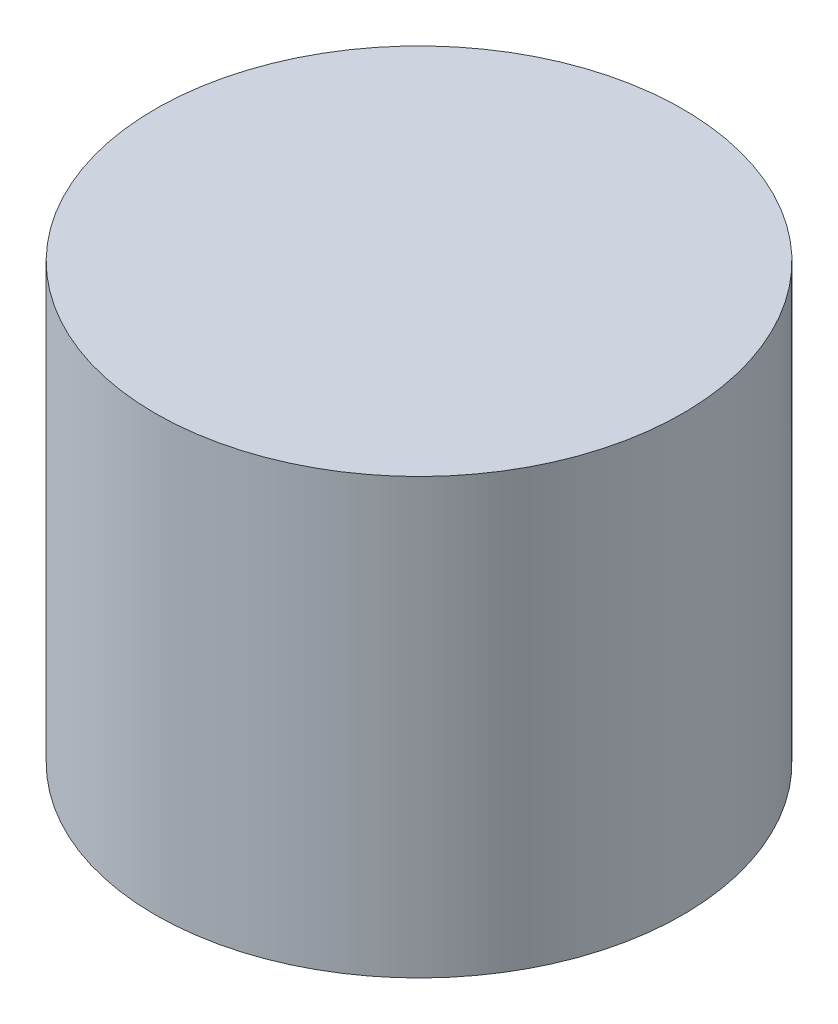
SolidWorks part; units mm, degrees
ref_plane "Front Plane" through (0, 0, 0) normal (0, 0, 1) x (1, 0, 0)
ref_plane "Top Plane" through (0, 0, 0) normal (0, 1, 0) x (1, 0, 0)
ref_plane "Right Plane" through (0, 0, 0) normal (1, 0, 0) x (0, 0, -1)
sketch "Sketch3" plane through (0, 0, 0) normal (0, 1, 0) x (-1, 0, 0)
  circle A1 centre (54, 28) radius 4.25
extrude "Boss-Extrude1" add sketch "Sketch3" along normal blind 7
